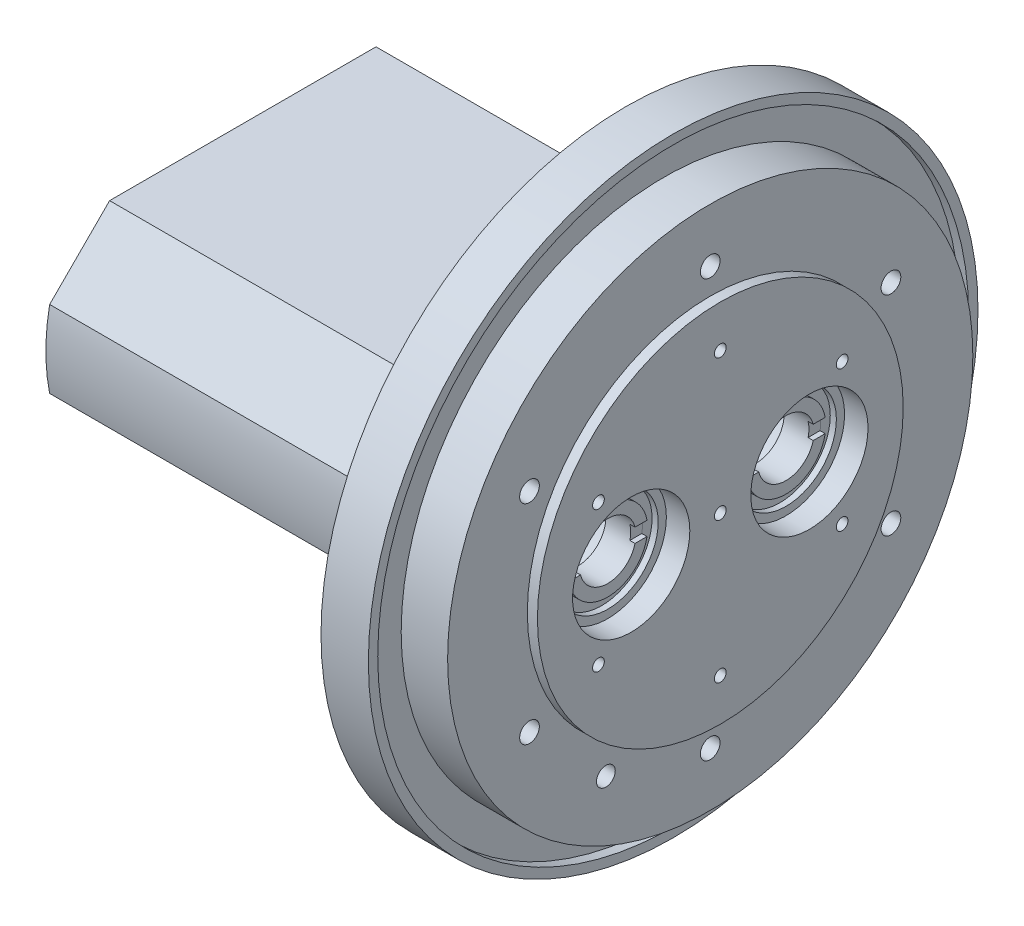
SolidWorks part; units mm, degrees
ref_plane "Vorne" through (0, 0, 0) normal (0, 0, 1) x (1, 0, 0)
ref_plane "Oben" through (0, 0, 0) normal (0, 1, 0) x (1, 0, 0)
ref_plane "Rechts" through (0, 0, 0) normal (1, 0, 0) x (0, 0, -1)
sketch "Skizze1" plane through (0, 0, 0) normal (0, 0, 1) x (1, 0, 0)
  line L0 (0, 0) -> (0, 39)
  line L1 (0, 39) -> (-2.15, 39)
  line L2 (-2.15, 39) -> (-2.15, 56)
  line L3 (-2.15, 56) -> (-12.05, 56)
  line L4 (-10.05, 63) -> (-10.05, 65)
  line L5 (-10.05, 65) -> (-20.15, 65)
  line L6 (-20.15, 65) -> (-20.15, 42)
  line L7 (-20.15, 42) -> (-101.82, 42)
  line L8 (-101.82, 42) -> (-101.82, 0)
  line L9 (-101.82, 0) -> (0, 0)
  line L10 (0, 0) -> (46.7397, 0) construction
  line L11 (-10.05, 63) -> (-12.05, 63)
  line L12 (-12.05, 63) -> (-12.05, 56)
  dimension "D1" = 65
  dimension "D2" = 39
  dimension "D3" = 56
  dimension "D4" = 2.15
  dimension "D5" = 7.9
  dimension "D6" = 10.1
  dimension "D7" = 101.82
  dimension "D8" = 42
  dimension "D9" = 2
  dimension "D10" = 63
revolve "Rotation1" add sketch "Skizze1" angle 360 about L10
sketch "Skizze2" plane through (-101.82, 0, 0) normal (-1, 0, 0) x (0, 0, 1)
  line L0 (-36.3731, 21) -> (36.3731, 21)
  line L1 (-36.3731, -21) -> (36.3731, -21)
  circle A0 centre (0, 0) radius 42 construction
  circle A1 centre (0, 0) radius 42 construction
  arc A2 (-36.3731, -21) -> (36.3731, -21) centre (0, 0) ccw
  arc A3 (36.3731, 21) -> (-36.3731, 21) centre (0, 0) ccw
  dimension "D1" = 21
  dimension "D2" = 21
extrude "Linear austragen1" cut sketch "Skizze2" against normal up to surface (81.67 mm away)
sketch "Skizze3" plane through (-101.82, 0, 0) normal (-1, 0, 0) x (0, 0, 1)
  circle A0 centre (-19, 0) radius 13
  circle A1 centre (19, 0) radius 13
  dimension "D1" = 26
  dimension "D2" = 26
  dimension "D3" = 19
  dimension "D4" = 38
extrude "Linear austragen2" cut sketch "Skizze3" against normal offset from surface (90.42 mm away) 11.4
sketch "Skizze4" plane through (0, 0, 0) normal (0, 0, 1) x (1, 0, 0)
  line L0 (-20.15, 51.1) -> (-16.15, 51.1)
  line L1 (-20.15, 65) -> (-20.15, -65) construction
  line L2 (-16.15, 51.1) -> (-16.15, 47)
  line L3 (-16.15, 47) -> (-18.2, 47)
  line L4 (-18.2, 47) -> (-18.2, 42)
  line L5 (-18.2, 42) -> (-20.15, 42)
  line L6 (-20.15, 51.1) -> (-20.15, 42)
  line L7 (-20.15, 0) -> (-101.82, 0) construction
  line L8 (-10.05, 0) -> (-20.15, 0) construction
  dimension "D1" = 42
  dimension "D2" = 47
  dimension "D3" = 51.1
  dimension "D4" = 4
  dimension "D5" = 2.05
revolve "Schnitt-Rotation1" cut sketch "Skizze4" angle 360 about axis through (0, 0, 0) along (-1, 0, 0)
hole_wizard "M5 Gewindebohrung1" positions "Skizze7" profile "Skizze6" tap size "M5" standard "ISO"
sketch "Skizze7" plane through (-2.15, 0, 0) normal (1, 0, 0) x (0, 0, -1)
  point P0 (0, 44.5)
  dimension "D1" = 44.5
sketch "Skizze6" plane through (-2.15, 44.5, 0) normal (0, 1, 0) x (0, 0, -1)
  line L0 (0, 0) -> (0, 13.2618)
  line L1 (0, 13.2618) -> (2.1, 12)
  line L2 (2.1, 12) -> (2.1, 0)
  line L5 (2.1, 0) -> (0, 0)
  line L10 (0, 13.2618) -> (-2.1, 12) construction
  line L11 (0, -6.35) -> (0, 107.95) construction
  dimension "Bohrerdurchmesser" = 4.2
  dimension "Bohrungstiefe" = 12
  dimension "Spitzenwinkel" = 118
pattern_circular "Kreismuster1" count 6 over 360 about axis through (0, 0, 0) along (1, 0, 0) of "M5 Gewindebohrung1"
hole_wizard "M3 Gewindebohrung1" positions "Skizze9" profile "Skizze8" tap size "M3" standard "ISO"
sketch "Skizze9" plane through (-101.82, 0, 0) normal (-1, 0, 0) x (0, 0, 1)
  point P0 (-35.15, 0)
  dimension "D1" = 16.15
sketch "Skizze8" plane through (-101.82, 0, -35.15) normal (0, 1, 0) x (0, 0, 1)
  line L0 (0, 0) -> (0, 9.2511)
  line L1 (0, 9.2511) -> (1.25, 8.5)
  line L2 (1.25, 8.5) -> (1.25, 0)
  line L5 (1.25, 0) -> (0, 0)
  line L10 (0, 9.2511) -> (-1.25, 8.5) construction
  line L11 (0, -6.35) -> (0, 107.95) construction
  dimension "Bohrerdurchmesser" = 2.5
  dimension "Bohrungstiefe" = 8.5
  dimension "Spitzenwinkel" = 118
pattern_circular "Kreismuster2" count 4 over 360 about axis through (0, 0, -19) along (1, 0, 0) of "M3 Gewindebohrung1"
hole_wizard "M3 Gewindebohrung2" positions "Skizze11" profile "Skizze10" tap size "M3" standard "ISO"
sketch "Skizze11" plane through (-101.82, 0, 0) normal (-1, 0, 0) x (0, 0, 1)
  point P0 (35.15, 0)
  dimension "D1" = 16.15
sketch "Skizze10" plane through (-101.82, 0, 35.15) normal (0, 1, 0) x (0, 0, 1)
  line L0 (0, 0) -> (0, 9.2511)
  line L1 (0, 9.2511) -> (1.25, 8.5)
  line L2 (1.25, 8.5) -> (1.25, 0)
  line L5 (1.25, 0) -> (0, 0)
  line L10 (0, 9.2511) -> (-1.25, 8.5) construction
  line L11 (0, -6.35) -> (0, 107.95) construction
  dimension "Bohrerdurchmesser" = 2.5
  dimension "Bohrungstiefe" = 8.5
  dimension "Spitzenwinkel" = 118
pattern_circular "Kreismuster3" count 4 over 360 about axis through (0, 0, 19) along (1, 0, 0) of "M3 Gewindebohrung2"
sketch "Skizze12" plane through (0, 0, 0) normal (1, 0, 0) x (0, 0, -1)
  circle A0 centre (-19, 0) radius 6
  circle A1 centre (19, 0) radius 6
  dimension "D1" = 19
  dimension "D2" = 38
  dimension "D3" = 12
  dimension "D4" = 12
extrude "Linear austragen3" cut sketch "Skizze12" against normal up to next
sketch "Skizze14" plane through (0, 0, 0) normal (1, 0, 0) x (0, 0, -1)
  circle A0 centre (-19, 0) radius 12.5
  circle A1 centre (19, 0) radius 12.5
  dimension "D1" = 25
  dimension "D2" = 25
extrude "Linear austragen4" cut sketch "Skizze14" against normal blind 5
sketch "Skizze15" plane through (-5, 0, 0) normal (1, 0, 0) x (0, 0, -1)
  circle A0 centre (-19, 0) radius 10.75
  circle A1 centre (-19, 0) radius 8.5
  circle A2 centre (19, 0) radius 10.75
  circle A3 centre (19, 0) radius 8.5
  dimension "D1" = 21.5
  dimension "D2" = 17
  dimension "D3" = 21.5
  dimension "D4" = 17
extrude "Linear austragen5" cut sketch "Skizze15" against normal blind 1.3
sketch "Skizze17" plane through (-5, 0, 0) normal (1, 0, 0) x (0, 0, -1)
  line L1 (-27.3666, -1.5) -> (-10.6334, -1.5)
  line L3 (-27.3666, 1.5) -> (-10.6334, 1.5)
  line L5 (10.6334, -1.5) -> (27.3666, -1.5)
  line L7 (10.6334, 1.5) -> (27.3666, 1.5)
  circle A0 centre (-19, 0) radius 8.5 construction
  arc A1 (-27.3666, 1.5) -> (-27.3666, -1.5) centre (-19, 0) ccw
  arc A2 (-10.6334, -1.5) -> (-10.6334, 1.5) centre (-19, 0) ccw
  circle A3 centre (19, 0) radius 8.5 construction
  arc A4 (10.6334, 1.5) -> (10.6334, -1.5) centre (19, 0) ccw
  arc A5 (27.3666, -1.5) -> (27.3666, 1.5) centre (19, 0) ccw
  dimension "D1" = 1.5
  dimension "D2" = 3
extrude "Linear austragen7" cut sketch "Skizze17" against normal blind 1.1
hole_wizard "M3 Gewindebohrung3" positions "Skizze19" profile "Skizze18" tap size "M3" standard "ISO"
sketch "Skizze19" plane through (0, 0, 0) normal (1, 0, 0) x (0, 0, -1)
  point P0 (0, 30)
  dimension "D1" = 30
sketch "Skizze18" plane through (0, 30, 0) normal (0, 1, 0) x (0, 0, -1)
  line L0 (0, 0) -> (0, 11.2511)
  line L1 (0, 11.2511) -> (1.25, 10.5)
  line L2 (1.25, 10.5) -> (1.25, 0)
  line L5 (1.25, 0) -> (0, 0)
  line L10 (0, 11.2511) -> (-1.25, 10.5) construction
  line L11 (0, -6.35) -> (0, 107.95) construction
  dimension "Bohrerdurchmesser" = 2.5
  dimension "Bohrungstiefe" = 10.5
  dimension "Spitzenwinkel" = 118
pattern_circular "Kreismuster4" count 6 over 360 about axis through (0, 0, 0) along (1, 0, 0) of "M3 Gewindebohrung3"
hole_wizard "M3 Gewindebohrung4" positions "Skizze21" profile "Skizze20" tap size "M3" standard "ISO"
sketch "Skizze21" plane through (0, 0, 0) normal (1, 0, 0) x (0, 0, -1)
  point P0 (0, 0)
sketch "Skizze20" plane through (0, 0, 0) normal (0, 1, 0) x (0, 0, -1)
  line L0 (0, 0) -> (0, 11.2511)
  line L1 (0, 11.2511) -> (1.25, 10.5)
  line L2 (1.25, 10.5) -> (1.25, 0)
  line L5 (1.25, 0) -> (0, 0)
  line L10 (0, 11.2511) -> (-1.25, 10.5) construction
  line L11 (0, -6.35) -> (0, 107.95) construction
  dimension "Bohrerdurchmesser" = 2.5
  dimension "Bohrungstiefe" = 10.5
  dimension "Spitzenwinkel" = 118
sketch "Skizze22" plane through (-101.82, 0, 0) normal (-1, 0, 0) x (0, 0, 1)
  line L0 (-10.6066, 21) -> (0, 10.3934)
  line L1 (-36.3731, 21) -> (36.3731, 21) construction
  line L2 (0, 10.3934) -> (10.6066, 21)
  line L3 (-10.6066, -21) -> (0, -10.3934)
  line L4 (36.3731, -21) -> (-36.3731, -21) construction
  line L5 (0, -10.3934) -> (10.6066, -21)
  line L6 (0, -10.3934) -> (0, 10.3934) construction
  line L7 (-36.3731, 21) -> (36.3731, 21) construction
  line L8 (-10.6066, 21) -> (10.6066, 21)
  line L9 (36.3731, -21) -> (-36.3731, -21) construction
  line L10 (10.6066, -21) -> (-10.6066, -21)
  dimension "D1" = 45
  dimension "D2" = 45
  dimension "D3" = 15
  dimension "D4" = 6.0858
extrude "Linear austragen8" cut sketch "Skizze22" against normal blind 20 from offset 59
fillet "Verrundung1" radius 6 4 edges at (-22.82, 15.6967, -5.3033) (-42.82, 15.6967, -5.3033) (-22.82, -15.6967, 5.3033) (-42.82, -15.6967, 5.3033)
sketch "Skizze23" plane through (-101.82, 0, 0) normal (-1, 0, 0) x (0, 0, 1)
  line L0 (-28.4056, -21) -> (-41.1883, -8.2173)
  line L1 (36.3731, -21) -> (-36.3731, -21) construction
  line L2 (-34.7969, -14.6086) -> (-28.7673, -8.579) construction
  line L3 (-28.4056, 21) -> (-41.1883, 8.2173)
  line L5 (28.4056, 21) -> (41.1883, 8.2173)
  line L6 (28.4056, -21) -> (41.1883, -8.2173)
  line L7 (36.3731, -21) -> (28.4056, -21)
  line L8 (-36.3731, 21) -> (36.3731, 21) construction
  line L9 (-36.3731, 21) -> (-28.4056, 21)
  line L10 (28.4056, 21) -> (36.3731, 21)
  line L11 (-28.4056, -21) -> (-36.3731, -21)
  circle A0 centre (0, 0) radius 42 construction
  arc A1 (-36.3731, 21) -> (-36.3731, -21) centre (0, 0) ccw construction
  arc A2 (36.3731, -21) -> (36.3731, 21) centre (0, 0) ccw construction
  circle A3 centre (-19, 0) radius 13 construction
  arc A4 (-36.3731, 21) -> (-41.1883, 8.2173) centre (0, 0) ccw
  arc A5 (36.3731, -21) -> (41.1883, -8.2173) centre (0, 0) ccw
  arc A6 (-41.1883, -8.2173) -> (-36.3731, -21) centre (0, 0) ccw
  arc A7 (41.1883, 8.2173) -> (36.3731, 21) centre (0, 0) ccw
  dimension "D1" = 45
  dimension "D2" = 21.5
extrude "Linear austragen9" cut sketch "Skizze23" against normal up to surface (81.67 mm away)
hole_wizard "M3 Gewindebohrung5" positions "Skizze25" profile "Skizze26" tap size "M3" standard "ISO"
sketch "Skizze25" plane through (0, 5.1967, -5.1967) normal (0, 0.7071, -0.7071) x (-1, 0, 0)
  line L0 (11.4, 13.435) -> (101.82, 13.435) construction
  line L2 (32.82, 13.435) -> (32.82, 22.3492) construction
  line L3 (22.82, 22.3492) -> (42.82, 22.3492) construction
  point P0 (32.82, 13.435)
sketch "Skizze26" plane through (-32.82, 14.6967, 4.3033) normal (1, 0, 0) x (0, 0.7071, 0.7071)
  line L0 (0, 0) -> (0, 99.2731)
  line L1 (0, 99.2731) -> (1.25, 99.2731)
  line L2 (1.25, 99.2731) -> (1.25, 0)
  line L5 (1.25, 0) -> (0, 0)
  line L11 (0, -6.35) -> (0, 107.95) construction
  dimension "Bohrerdurchmesser" = 2.5
  dimension "Bohrungstiefe" = 99.2731
hole_wizard "M3 Gewindebohrung6" positions "Skizze28" profile "Skizze29" tap size "M3" standard "ISO"
sketch "Skizze28" plane through (0, 5.1967, 5.1967) normal (0, 0.7071, 0.7071) x (1, 0, 0)
  line L0 (-11.4, 13.435) -> (-101.82, 13.435) construction
  line L1 (-32.82, 13.435) -> (-32.82, 22.3492) construction
  line L2 (-28.82, 22.3492) -> (-36.82, 22.3492) construction
  point P0 (-32.82, 13.435)
sketch "Skizze29" plane through (-32.82, 14.6967, -4.3033) normal (1, 0, 0) x (0, -0.7071, 0.7071)
  line L0 (0, 0) -> (0, 99.2731)
  line L1 (0, 99.2731) -> (1.25, 99.2731)
  line L2 (1.25, 99.2731) -> (1.25, 0)
  line L5 (1.25, 0) -> (0, 0)
  line L11 (0, -6.35) -> (0, 107.95) construction
  dimension "Bohrerdurchmesser" = 2.5
  dimension "Bohrungstiefe" = 99.2731
hole_wizard "M3 Gewindebohrung7" positions "Skizze31" profile "Skizze30" tap size "M3" standard "ISO"
sketch "Skizze31" plane through (0, -5.1967, -5.1967) normal (0, -0.7071, -0.7071) x (-1, 0, 0)
  line L0 (11.4, -13.435) -> (101.82, -13.435) construction
  line L1 (32.82, -13.435) -> (32.82, -22.3492) construction
  line L2 (28.82, -22.3492) -> (36.82, -22.3492) construction
  point P0 (32.82, -13.435)
sketch "Skizze30" plane through (-32.82, -14.6967, 4.3033) normal (1, 0, 0) x (0, 0.7071, -0.7071)
  line L0 (0, 0) -> (0, 99.2731)
  line L1 (0, 99.2731) -> (1.25, 99.2731)
  line L2 (1.25, 99.2731) -> (1.25, 0)
  line L5 (1.25, 0) -> (0, 0)
  line L11 (0, -6.35) -> (0, 107.95) construction
  dimension "Bohrerdurchmesser" = 2.5
  dimension "Bohrungstiefe" = 99.2731
hole_wizard "M3 Gewindebohrung8" positions "Skizze33" profile "Skizze32" tap size "M3" standard "ISO"
sketch "Skizze33" plane through (0, -5.1967, 5.1967) normal (0, -0.7071, 0.7071) x (1, 0, 0)
  line L0 (-11.4, -13.435) -> (-101.82, -13.435) construction
  line L1 (-32.82, -13.435) -> (-32.82, -22.3492) construction
  line L2 (-22.82, -22.3492) -> (-42.82, -22.3492) construction
  point P0 (-32.82, -13.435)
sketch "Skizze32" plane through (-32.82, -14.6967, -4.3033) normal (1, 0, 0) x (0, -0.7071, -0.7071)
  line L0 (0, 0) -> (0, 99.2731)
  line L1 (0, 99.2731) -> (1.25, 99.2731)
  line L2 (1.25, 99.2731) -> (1.25, 0)
  line L5 (1.25, 0) -> (0, 0)
  line L11 (0, -6.35) -> (0, 107.95) construction
  dimension "Bohrerdurchmesser" = 2.5
  dimension "Bohrungstiefe" = 99.2731
sketch "Skizze34" plane through (0, -21, 0) normal (0, 1, 0) x (1, 0, 0)
  line L0 (-11.4, 19) -> (-101.82, 19) construction
  line L1 (-11.4, -19) -> (-101.82, -19) construction
  line L2 (-101.82, 41.1883) -> (-101.82, 28.4056) construction
  circle A0 centre (-81.82, 19) radius 0.6
  circle A1 centre (-81.82, -19) radius 0.6
  dimension "D1" = 1.2
  dimension "D2" = 1.2
  dimension "D3" = 20
extrude "Linear austragen10" cut sketch "Skizze34" along normal up to next
hole_wizard "Ø4.0 (4) Durchmesser Bohrung1" positions "Skizze36" profile "Skizze35" hole size "Ø4.0" standard "ISO"
sketch "Skizze36" plane through (-2.15, 0, 0) normal (1, 0, 0) x (0, 0, -1)
  line L0 (0, 18.284) -> (0, 0) construction
  line L1 (0, 0) -> (-22.25, -38.5381) construction
  circle A0 centre (0, 0) radius 44.5
  point P0 (-22.25, -38.5381)
  dimension "D1" = 210
sketch "Skizze35" plane through (-2.15, -38.5381, 22.25) normal (0, 1, 0) x (0, 0, -1)
  line L0 (0, 0) -> (0, 6.2017)
  line L1 (0, 6.2017) -> (2, 5)
  line L2 (2, 5) -> (2, 0)
  line L5 (2, 0) -> (0, 0)
  line L10 (0, 6.2017) -> (-2, 5) construction
  line L11 (0, -6.35) -> (0, 107.95) construction
  dimension "Bohrerdurchmesser" = 4
  dimension "Bohrungstiefe" = 5
  dimension "Spitzenwinkel" = 118
